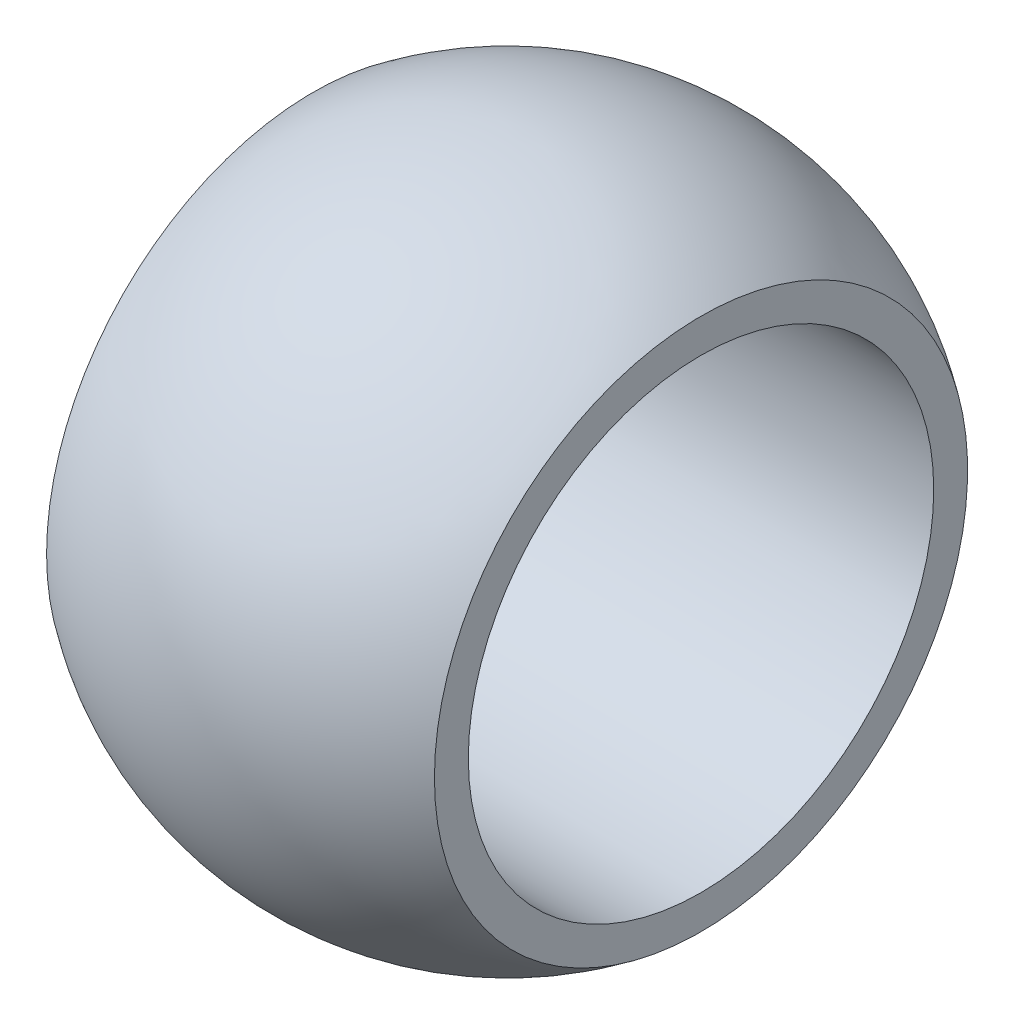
SolidWorks part; units mm, degrees
ref_plane "Plane1" through (0, 0, 0) normal (0, 0, 1) x (1, 0, 0)
ref_plane "Plane2" through (0, 0, 0) normal (0, 1, 0) x (1, 0, 0)
ref_plane "Plane3" through (0, 0, 0) normal (1, 0, 0) x (0, 0, -1)
sketch "Esquisse1" plane through (0, 0, 0) normal (0, 0, 1) x (1, 0, 0)
  line L0 (-70, 0) -> (70, 0) construction
  line L1 (0, 70) -> (0, -70) construction
  line L3 (5, 6.8739) -> (5, 6)
  line L4 (-5, 6) -> (5, 6)
  line L5 (-5, 6.8739) -> (-5, 6)
  arc A0 (5, 6.8739) -> (-5, 6.8739) centre (0, 0) ccw
  point P11 (0, 6)
  dimension "D2" = 8.5
  dimension "D1" = 5
  dimension "D3" = 6
revolve "Base-Révolution" add sketch "Esquisse1" angle 360 about L0
